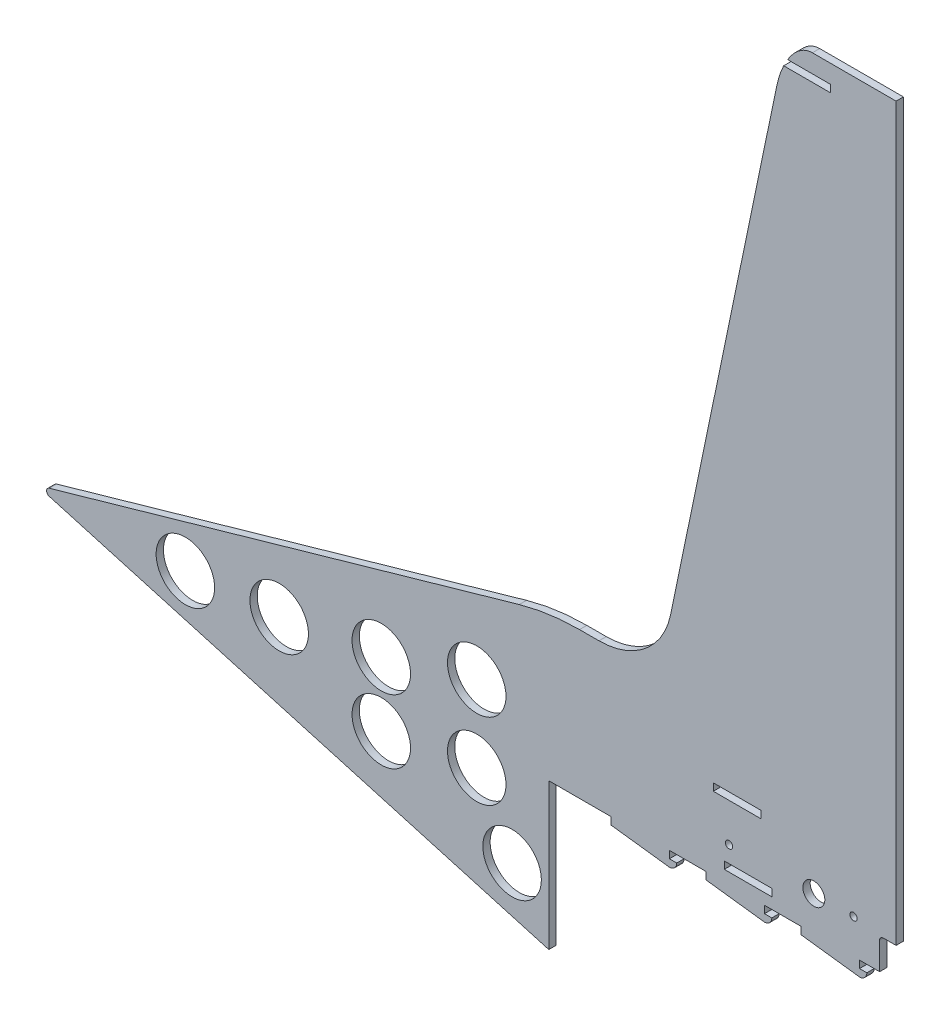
SolidWorks part; units mm, degrees
ref_plane "Front Plane" through (0, 0, 0) normal (0, 0, 1) x (1, 0, 0)
ref_plane "Top Plane" through (0, 0, 0) normal (0, 1, 0) x (1, 0, 0)
ref_plane "Right Plane" through (0, 0, 0) normal (1, 0, 0) x (0, 0, -1)
sketch "Sketch1" plane through (0, 0, 0) normal (0, 0, 1) x (1, 0, 0)
  line L0 (-65, 0) -> (-4.5, 0)
  line L2 (-65, 40) -> (-30, 208.48)
  line L3 (-30, 208.48) -> (0, 208.48)
  line L4 (0, 208.48) -> (0, 8.48)
  line L5 (-65, 0) -> (-95, 0)
  line L6 (-95, 0) -> (-95, -40)
  line L7 (-95, -40) -> (-235, 0)
  line L8 (-235, 0) -> (-95, 40)
  line L9 (0, 8.48) -> (-3.5, 8.48)
  line L10 (-95, 40) -> (-65, 40)
  line L11 (-4.5, 7.48) -> (-4.5, 0)
  arc A0 (-3.5, 8.48) -> (-4.5, 7.48) centre (-3.5, 7.48) ccw
  circle A1 centre (-114.7072, 14.1089) radius 8
  circle A2 centre (-114.7072, -6.7963) radius 8
  circle A3 centre (-140.8169, 6.358) radius 8
  circle A4 centre (-168.7393, 1.8838) radius 8
  circle A5 centre (-140.8169, -11.189) radius 8
  circle A6 centre (-194.3981, 0) radius 8
  circle A7 centre (-105.0322, -24.5328) radius 8
extrude "Boss-Extrude1" add sketch "Sketch1" along normal blind 2
fillet "Fillet2" radius 10 1 edges at (-30, 208.48, 1)
fillet "Fillet3" radius 20 1 edges at (-65, 40, 1)
fillet "Fillet4" radius 60 1 edges at (-95, 40, 1)
fillet "Fillet5" radius 1 1 edges at (-235, 0, 1)
other "Cavity2"
other "PlaTensor<1>@body2"
sketch "Sketch2" plane through (0, 0, 0) normal (0, -1, 0) x (1, 0, 0)
  line L0 (-95, 0) -> (-4.5, 0) construction
  line L1 (-10, 0) -> (-26, 0)
  line L2 (-10, 0) -> (-10, 2)
  line L3 (-10, 2) -> (-26, 2)
  line L4 (-26, 0) -> (-26, 2)
  line L5 (-95, 2) -> (-4.5, 2) construction
  line L6 (0, 2) -> (0, 0) construction
  point P10 (-26, 1)
  dimension "D1" = 10
  dimension "D2" = 16
extrude "Boss-Extrude2" add sketch "Sketch2" along normal blind 2
sketch "Sketch3" plane through (0, 0, 0) normal (0, 0, -1) x (-1, 0, 0)
  line L0 (26, -2) -> (10, -4)
  line L1 (26, -2) -> (10, -2)
  line L2 (10, -2) -> (8, -2)
  arc A0 (10, -4) -> (8, -2) centre (10, -2) cw
extrude "Boss-Extrude3" add sketch "Sketch3" against normal blind 2
pattern_linear "LPattern1" count 3 spacing 26 along (-1, 0, 0) of "Boss-Extrude3", "Boss-Extrude2"
other "Cavity3"
other "veryToptop<1>@body1"
sketch "Sketch4" plane through (0, 0, 0) normal (0, 0, -1) x (-1, 0, 0)
  line L27 (18, 203.48) -> (29.6752, 203.48)
  line L28 (18, 201.48) -> (18, 203.48)
  line L30 (18, 203.48) -> (29.6752, 203.48)
  line L32 (0, 8.48) -> (3.5, 8.48)
  line L33 (4.5, 7.48) -> (4.5, 0)
  line L34 (4.5, 0) -> (10, 0)
  line L35 (10, 0) -> (10, -2)
  line L36 (10, -2) -> (8, -2)
  line L37 (10, -4) -> (26, -2)
  line L38 (26, -2) -> (26, 0)
  line L39 (26, 0) -> (36, 0)
  line L40 (36, 0) -> (36, -2)
  line L41 (36, -2) -> (34, -2)
  line L42 (36, -4) -> (52, -2)
  line L43 (52, -2) -> (52, 0)
  line L44 (52, 0) -> (62, 0)
  line L45 (62, 0) -> (62, -2)
  line L46 (62, -2) -> (60, -2)
  line L47 (62, -4) -> (78, -2)
  line L48 (78, -2) -> (78, 0)
  line L49 (78, 0) -> (95, 0)
  line L50 (95, 0) -> (95, -40)
  line L51 (95, -40) -> (231.6347, -0.9615)
  line L52 (231.6347, 0.9615) -> (103.08, 37.6914)
  line L53 (86.5967, 40) -> (81.2722, 40)
  line L54 (61.6903, 55.9321) -> (32.6936, 195.5139)
  line L55 (30.7454, 201.48) -> (18, 201.48)
  line L56 (18, 201.48) -> (18, 203.48)
  line L60 (0, 8.48) -> (3.5, 8.48)
  line L61 (4.5, 7.48) -> (4.5, 0)
  line L62 (4.5, 0) -> (10, 0)
  line L63 (10, 0) -> (10, -2)
  line L64 (10, -2) -> (8, -2)
  line L65 (10, -4) -> (26, -2)
  line L66 (26, -2) -> (26, 0)
  line L67 (26, 0) -> (36, 0)
  line L68 (36, 0) -> (36, -2)
  line L69 (36, -2) -> (34, -2)
  line L70 (36, -4) -> (52, -2)
  line L71 (52, -2) -> (52, 0)
  line L72 (52, 0) -> (62, 0)
  line L73 (62, 0) -> (62, -2)
  line L74 (62, -2) -> (60, -2)
  line L75 (62, -4) -> (78, -2)
  line L76 (78, -2) -> (78, 0)
  line L77 (78, 0) -> (95, 0)
  line L78 (95, 0) -> (95, -40)
  line L79 (95, -40) -> (231.6347, -0.9615)
  line L80 (231.6347, 0.9615) -> (103.08, 37.6914)
  line L81 (86.5967, 40) -> (81.2722, 40)
  line L82 (61.6903, 55.9321) -> (32.6936, 195.5139)
  line L83 (30.7454, 201.48) -> (18, 201.48)
  line L85 (22.9026, 208.48) -> (0, 208.48)
  line L86 (22.9026, 208.48) -> (0, 208.48)
  line L87 (0, 208.48) -> (0, 8.48)
  line L88 (0, 208.48) -> (0, 8.48)
  arc A7 (4.5, 7.48) -> (3.5, 8.48) centre (3.5, 7.48) ccw
  arc A8 (8, -2) -> (10, -4) centre (10, -2) ccw
  arc A9 (34, -2) -> (36, -4) centre (36, -2) ccw
  arc A10 (60, -2) -> (62, -4) centre (62, -2) ccw
  arc A11 (231.6347, -0.9615) -> (231.6347, 0.9615) centre (231.3599, 0) ccw
  arc A12 (103.08, 37.6914) -> (86.5967, 40) centre (86.5967, -20) ccw
  arc A13 (61.6903, 55.9321) -> (81.2722, 40) centre (81.2722, 60) ccw
  arc A14 (4.5, 7.48) -> (3.5, 8.48) centre (3.5, 7.48) ccw
  arc A15 (8, -2) -> (10, -4) centre (10, -2) ccw
  arc A16 (34, -2) -> (36, -4) centre (36, -2) ccw
  arc A17 (60, -2) -> (62, -4) centre (62, -2) ccw
  arc A18 (231.6347, -0.9615) -> (231.6347, 0.9615) centre (231.3599, 0) ccw
  arc A19 (103.08, 37.6914) -> (86.5967, 40) centre (86.5967, -20) ccw
  arc A20 (61.6903, 55.9321) -> (81.2722, 40) centre (81.2722, 60) ccw
  spline S2 degree 2 poles (-1362.3537, -2450.2183) (110.9976, 71.8989) (29.6281, 203.5566) (28.3553, 205.616) (26.8467, 206.865) (25.9497, 207.6075) (25.0195, 208.0142) (-61.5227, 245.8466) (-54.7846, -2789.1467) knots -18.496151 -18.496151 -18.496151 0.5 0.5 0.75 0.75 0.875 0.875 11.027747 11.027747 11.027747 only from (29.6752, 203.48) to (22.9026, 208.48)
  spline S3 degree 2 poles (-2184.8646, -1816.6801) (98.5377, 20.1823) (31.5003, 199.6771) (-33.0262, 372.4488) (-1841.6597, -2136.8201) knots -22.405925 -22.405925 -22.405925 0.25 0.25 20.370914 20.370914 20.370914 only from (32.6936, 195.5139) to (30.7454, 201.48)
  spline S4 degree 2 poles (29.6752, 203.48) (29.6517, 203.5184) (29.6281, 203.5566) (28.3553, 205.616) (26.8467, 206.865) (25.9497, 207.6075) (25.0195, 208.0142) (23.954, 208.48) (22.9026, 208.48) knots 0.49449 0.49449 0.49449 0.5 0.5 0.75 0.75 0.875 0.875 1 1 1
  spline S5 degree 2 poles (32.6936, 195.5139) (32.24, 197.6964) (31.5003, 199.6771) (31.1488, 200.6183) (30.7454, 201.48) knots 0 0 0 0.25 0.25 0.359618 0.359618 0.359618
  dimension "D1" = 0
sketch "Sketch5" plane through (0, 0, 0) normal (0, 0, -1) x (-1, 0, 0)
  circle A0 centre (11.64, 9.5) radius 1 construction
  circle A1 centre (45.7, 9.5) radius 1 construction
  circle A2 centre (11.64, 9.5) radius 1
  circle A3 centre (45.7, 9.5) radius 1
extrude "Cut-Extrude1" cut sketch "Sketch5" against normal blind 2
other "Cavity4"
other "micH<1>@body1"
other "micH<2>@body1"
sketch "Sketch6" plane through (0, 0, 0) normal (0, 1, 0) x (1, 0, 0)
  line L0 (-27, -2) -> (-27, -18) construction
  circle A0 centre (-27, -10) radius 1.5
  dimension "D1" = 3
equation "\"anch\" = 2"
equation "\"alt\" = 100"
equation "\"pilanch\" = 100"
equation "\"pilalt\" = 250"
equation "\"bodyHeigh\" = 60"
equation "\"dorsalFinHeigh\" = 400"
equation "\"D1@Boss-Extrude1\"=\"anch\""
equation "\"D7@Sketch1\"=\"D2@Sketch1\""
equation "\"D1@Boss-Extrude2\"=\"anch\""
equation "\"D1@Sketch3\"=\"anch\""
equation "\"D1@Cut-Extrude1\"=\"anch\""
